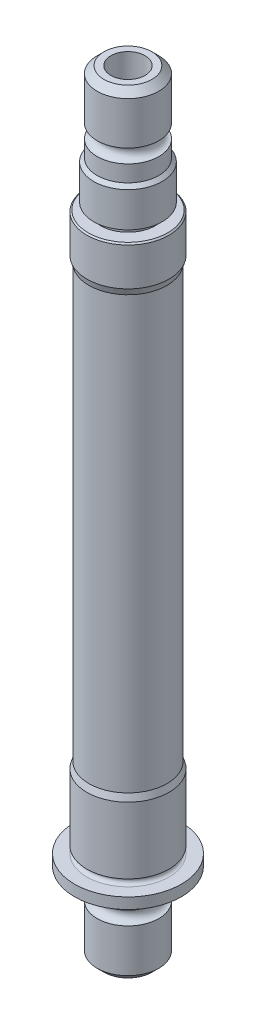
SolidWorks part; units mm, degrees
ref_plane "Plan de face" through (0, 0, 0) normal (0, 0, 1) x (1, 0, 0)
ref_plane "Plan de dessus" through (0, 0, 0) normal (0, 1, 0) x (1, 0, 0)
ref_plane "Plan de droite" through (0, 0, 0) normal (1, 0, 0) x (0, 0, -1)
ref_plane "Plan1" through (0, 0, 0) normal (0, 0, -1) x (-1, 0, 0)
sketch "Esquisse1" plane through (0, 0, 0) normal (0, 0, -1) x (-1, 0, 0)
  line L0 (-3.5, -113.9005) -> (0, -113.9005)
  line L1 (0, -113.9005) -> (0, -1.0005)
  line L2 (0, -1.0005) -> (-3.5, -1.0005)
  line L3 (-3.5, -1.0005) -> (-4.5, -2.0005)
  line L4 (-4.5, -2.0005) -> (-4.5, -8.257)
  line L5 (-4.5, -10.257) -> (-4.5, -12.657)
  line L6 (-4.5, -12.657) -> (-5, -13.157)
  line L7 (-5, -13.157) -> (-5, -18.251)
  line L8 (-5, -18.251) -> (-4, -18.251)
  line L9 (-4, -18.251) -> (-4, -19.251)
  line L10 (-4, -19.251) -> (-5.8, -19.251)
  line L11 (-5.8, -19.251) -> (-6, -19.451)
  line L12 (-6, -19.451) -> (-6, -25.0005)
  line L13 (-6, -25.0005) -> (-5.7, -25.9544)
  line L14 (-5.7, -25.9544) -> (-5.7, -88.9465)
  line L15 (-5.7, -88.9465) -> (-6, -89.9005)
  line L16 (-6, -89.9005) -> (-6, -99.6105)
  line L17 (-6.0001, -100.6105) -> (-7.8, -100.6105)
  line L18 (-7.8, -100.6105) -> (-7.8, -102.2105)
  line L19 (-7.8, -102.2105) -> (-4.5, -102.2105)
  line L20 (-4.5, -102.2105) -> (-4.5, -104.6105)
  line L21 (-4.5, -106.6105) -> (-4.5, -112.9005)
  line L22 (-4.5, -112.9005) -> (-3.5, -113.9005)
  line L23 (0, -113.9005) -> (0, -1.0005) construction
  arc A0 (-4.5, -8.257) -> (-4.5, -10.257) centre (-4.5, -9.257) cw
  arc A1 (-6, -99.6105) -> (-6.0001, -100.6105) centre (-6, -100.1105) cw
  arc A2 (-4.5, -104.6105) -> (-4.5, -106.6105) centre (-4.5, -105.6105) cw
  dimension "D1" = 5.7
  dimension "D2" = 62.9921
  dimension "D4" = 1
  dimension "D5" = 6
revolve "Révolution1" add sketch "Esquisse1" angle 360 about L23
sketch "Esquisse2" plane through (0, -113.9005, 0) normal (0, -1, 0) x (1, 0, 0)
  line L0 (1.7321, -3) -> (3.4641, 0)
  line L1 (3.4641, 0) -> (1.7321, 3)
  line L2 (1.7321, 3) -> (-1.7321, 3)
  line L3 (-1.7321, 3) -> (-3.4641, 0)
  line L4 (-3.4641, 0) -> (-1.7321, -3)
  line L5 (-1.7321, -3) -> (1.7321, -3)
extrude "Extrusion1" cut sketch "Esquisse2" against normal blind 3
sketch "Esquisse3" plane through (0, 0, 0) normal (0, 0, 1) x (1, 0, 0)
  line L0 (2.5, -1.0005) -> (0, -1.0005)
  line L1 (0, -1.0005) -> (0, -110.9005)
  line L2 (0, -110.9005) -> (2.5, -110.9005)
  line L3 (2.5, -110.9005) -> (2.5, -1.0005)
  line L4 (0, -1.0005) -> (0, -110.9005) construction
revolve "Enlèvement de matière-Révolution1" cut sketch "Esquisse3" angle 360 about L4
